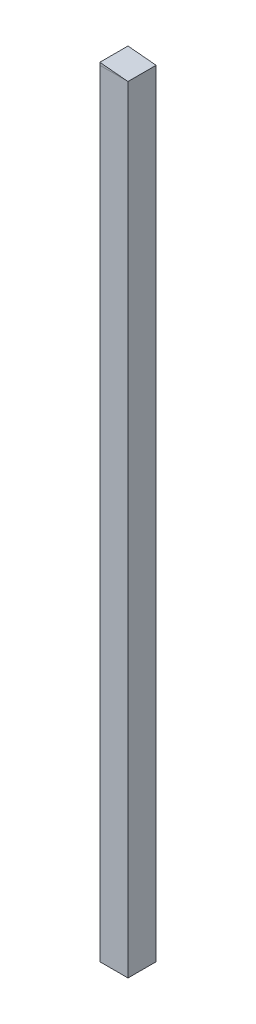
SolidWorks part; units mm, degrees
ref_plane "Face" through (0, 0, 0) normal (0, 0, 1) x (1, 0, 0)
ref_plane "Dessus" through (0, 0, 0) normal (0, 1, 0) x (1, 0, 0)
ref_plane "Droite" through (0, 0, 0) normal (1, 0, 0) x (0, 0, -1)
sketch "Esquisse1" plane through (0, 0, 0) normal (0, 1, 0) x (1, 0, 0)
  line L1 (0, 0) -> (10, 0)
  line L2 (0, 0) -> (0, 10)
  line L3 (0, 10) -> (10, 10)
  line L4 (10, 0) -> (10, 10)
  dimension "D1" = 10
  dimension "D2" = 10
extrude "Extrusion1" add sketch "Esquisse1" along normal blind 275.72
sketch "Esquisse2" plane through (0, 0, 0) normal (0, 0, 1) x (1, 0, 0)
  line L0 (10, 275.7162) -> (0, 276.646)
  line L1 (0, 275.72) -> (0, 0) construction
  line L2 (0, 275.72) -> (10, 275.7162)
  line L3 (10, 275.72) -> (10, 0) construction
  line L4 (0, 276.646) -> (0, 275.72)
  dimension "D1" = 5.29
  dimension "D2" = 275.72
extrude "Extrusion2" add sketch "Esquisse2" against normal blind 10
